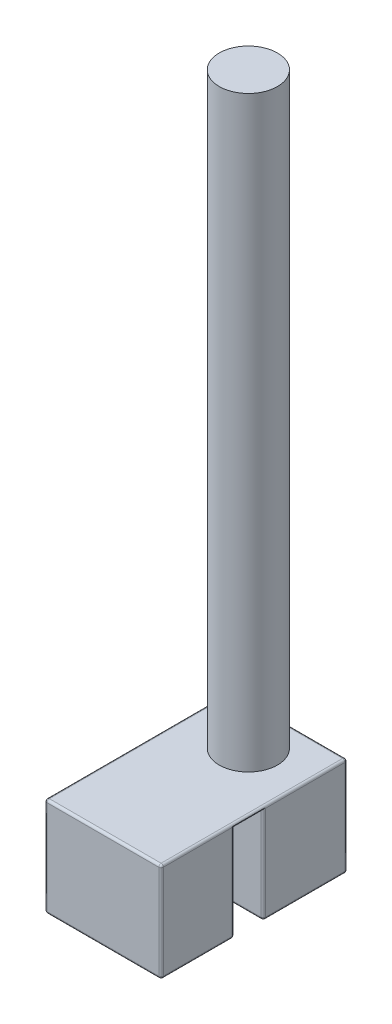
SolidWorks part; units mm, degrees
ref_plane "Front Plane" through (0, 0, 0) normal (0, 0, 1) x (1, 0, 0)
ref_plane "Top Plane" through (0, 0, 0) normal (0, 1, 0) x (1, 0, 0)
ref_plane "Right Plane" through (0, 0, 0) normal (1, 0, 0) x (0, 0, -1)
sketch "Sketch1" plane through (0, 0, 0) normal (0, 1, 0) x (1, 0, 0)
  line L1 (-60.0097, 18.558) -> (39.9903, 18.558)
  line L2 (-60.0097, 18.558) -> (-60.0097, -141.442)
  line L3 (-60.0097, -141.442) -> (39.9903, -141.442)
  line L4 (39.9903, 18.558) -> (39.9903, -141.442)
  dimension "D1" = 100
  dimension "D2" = 160
extrude "Boss-Extrude1" add sketch "Sketch1" along normal blind 85
sketch "Sketch2" plane through (0, 0, 0) normal (0, 1, 0) x (1, 0, 0)
  line L0 (-60.0097, 18.558) -> (39.9903, 18.558) construction
  line L3 (-60.0097, 18.558) -> (-60.0097, -141.442) construction
  circle A0 centre (-10.0097, -16.442) radius 25
  dimension "D1" = 35
  dimension "D2" = 50
  dimension "D3" = 50
extrude "Boss-Extrude2" add sketch "Sketch2" along normal blind 590
sketch "Sketch3" plane through (39.9903, 0, 0) normal (1, 0, 0) x (0, 0, -1)
  line L0 (-141.442, 0) -> (18.558, 0) construction
  line L1 (-78.6781, 82) -> (-53.6781, 82)
  line L2 (-78.6781, 82) -> (-78.6781, 0)
  line L3 (-78.6781, 0) -> (-53.6781, 0)
  line L4 (-53.6781, 82) -> (-53.6781, 0)
  line L5 (-78.6781, 82) -> (-53.6781, 0) construction
  line L6 (-78.6781, 0) -> (-53.6781, 82) construction
  line L7 (18.558, 0) -> (-141.442, 0) construction
  line L8 (-78.6781, 0) -> (-78.6781, 82) construction
  point P0 (-66.1781, 41)
  dimension "D1" = 82
  dimension "D2" = 25
extrude "Cut-Extrude1" cut sketch "Sketch3" against normal blind 70
fillet "Fillet2" radius 2 3 edges at (39.9903, 41, 53.6781) (39.9903, 82, 66.1781) (39.9903, 41, 78.6781)
fillet "Fillet3" radius 5 1 edges at (-30.0097, 82, 66.1781)
fillet "Fillet4" radius 2 17 edges at (3.9903, 0, 53.6781) (39.4046, 0, 53.0923) (3.9903, 0, 78.6781) (39.4046, 0, 79.2639) (-10.0097, 85, -18.558) (-60.0097, 42.5, -18.558) (-10.0097, 0, -18.558) (39.9903, 0, 16.56) (39.9903, 0, 111.06) (39.9903, 42.5, -18.558) (39.9903, 85, 61.442) (-10.0097, 85, 141.442) (39.9903, 42.5, 141.442) (-10.0097, 0, 141.442) (-60.0097, 0, 61.442) (-60.0097, 42.5, 141.442) (-60.0097, 85, 61.442)
